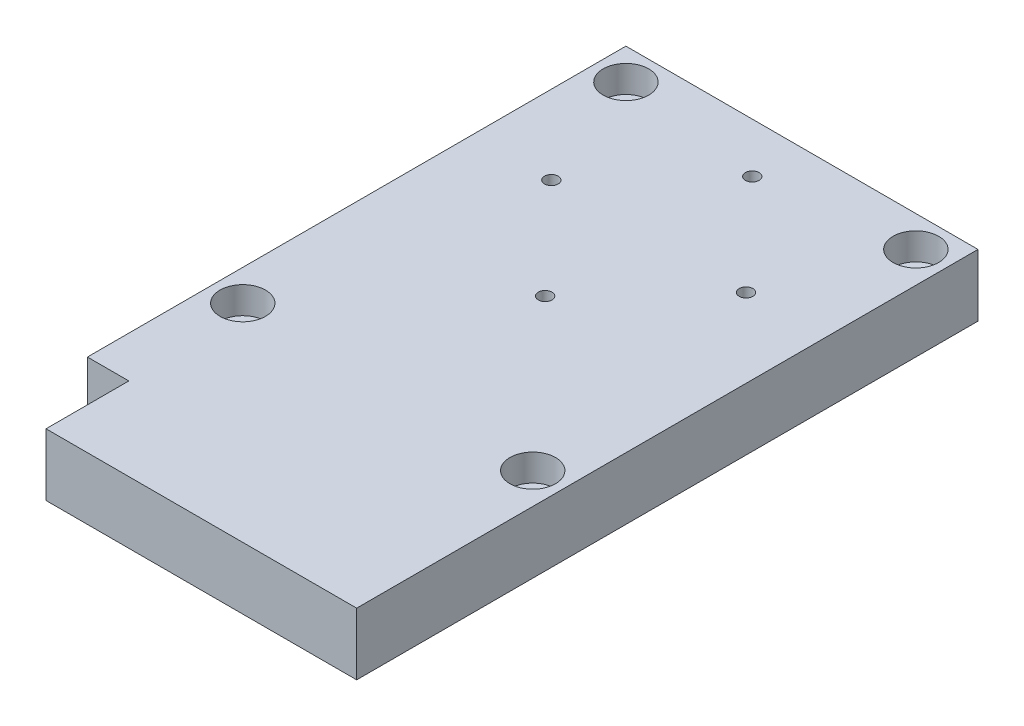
SolidWorks part; units mm, degrees
ref_plane "前视基准面" through (0, 0, 0) normal (0, 0, 1) x (1, 0, 0)
ref_plane "上视基准面" through (0, 0, 0) normal (0, 1, 0) x (1, 0, 0)
ref_plane "右视基准面" through (0, 0, 0) normal (1, 0, 0) x (0, 0, -1)
sketch "草图1" plane through (0, 0, 0) normal (0, 0, 1) x (1, 0, 0)
  line L0 (0, 0) -> (0, 15)
  line L1 (85, 0) -> (85, 15)
  line L2 (0, 15) -> (85, 15)
  line L3 (0, 0) -> (85, 0)
extrude "凸台-拉伸1" add sketch "草图1" along normal blind 150
sketch "草图2" plane through (0, 15, 0) normal (0, 1, 0) x (1, 0, 0)
  line L0 (0, -130) -> (10, -130)
  line L1 (10, -150) -> (10, -130)
  line L2 (0, -130) -> (0, -150)
  line L3 (0, -150) -> (10, -150)
  circle A0 centre (7.5, -7.5) radius 3.25
  circle A1 centre (77.5, -7.5) radius 3.25
  circle A2 centre (77.5, -100) radius 3.25
  circle A3 centre (7.5, -100) radius 3.25
  circle A4 centre (19, -37) radius 1.65
  circle A5 centre (66, -37) radius 1.65
  circle A6 centre (42.5, -62) radius 1.65
  circle A7 centre (42.5, -12) radius 1.65
extrude "切除-拉伸1" cut sketch "草图2" against normal blind 150
sketch "草图3" plane through (0, 15, 0) normal (0, 1, 0) x (1, 0, 0)
  circle A0 centre (7.5, -7.5) radius 5.5
  circle A1 centre (77.5, -7.5) radius 5.5
  circle A2 centre (77.5, -100) radius 5.5
  circle A3 centre (7.5, -100) radius 5.5
extrude "切除-拉伸2" cut sketch "草图3" against normal blind 6.5
